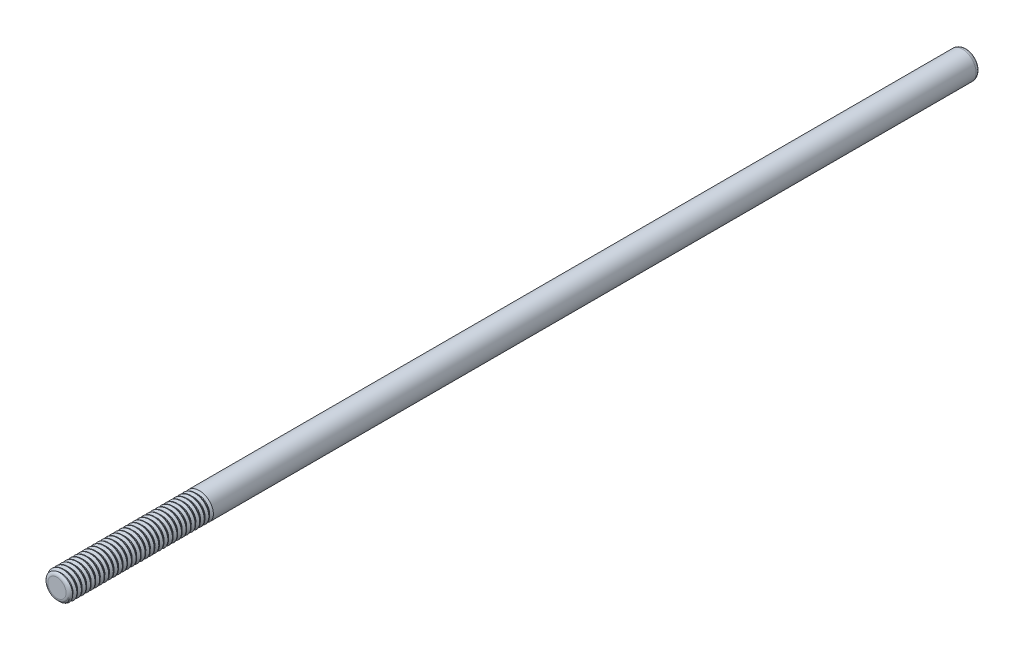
SolidWorks part; units mm, degrees
ref_plane "Front" through (0, 0, 0) normal (0, 0, 1) x (1, 0, 0)
ref_plane "Top" through (0, 0, 0) normal (0, 1, 0) x (1, 0, 0)
ref_plane "Right" through (0, 0, 0) normal (1, 0, 0) x (0, 0, -1)
sketch "Esquisse1" plane through (0, 0, 0) normal (0, 0, 1) x (1, 0, 0)
  circle A0 centre (0, 0) radius 3
  dimension "D1" = 6
extrude "Boss.-Extru.1" add sketch "Esquisse1" along normal blind 200
fillet "Congé1" radius 1 2 edges at (3, 0, 0) (3, 0, 200)
thread "Filetage1" pitch 1 start angle 0, offset 2, length 32, pitch 1, diameter 6
ref_plane "Plan1" through (-3, 0, 201) normal (0, -1, 0) x (-1, 0, 0)
sketch "Profil de filetage1" plane through (-3, 0, 201) normal (0, -1, 0) x (-1, 0, 0)
  line L0 (0, 0) -> (0, 1) construction
  line L11 (0, 0) -> (0, 0.875)
  line L12 (0, 0.875) -> (-0.5413, 0.5625)
  line L13 (-0.5413, 0.5625) -> (-0.5413, 0.3125)
  line L15 (-0.5413, 0.3125) -> (0, 0)
  line L17 (-0.5413, 0.4375) -> (0, 0.4375) construction
  point P2 (0, 0)
  dimension "Pitch" = 1
  dimension "Profile_Angle" = 60
  dimension "Profile_Land" = 0.25
  dimension "Profile_Height" = 0.5413
